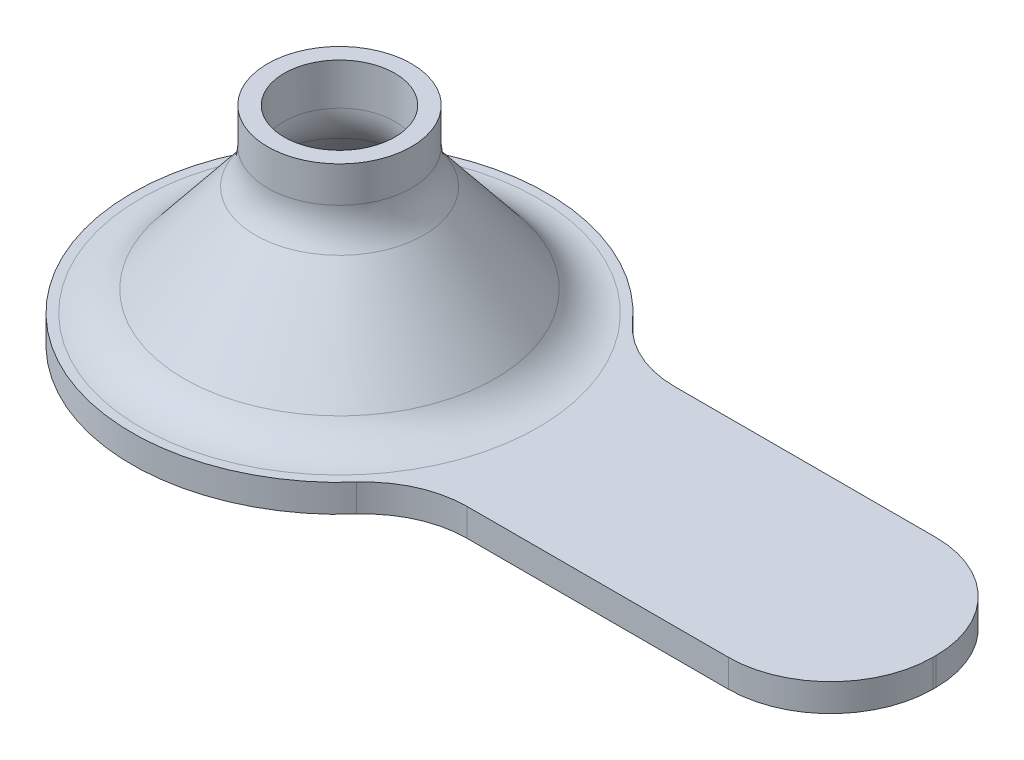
SolidWorks part; units mm, degrees
ref_plane "Front Plane" through (0, 0, 0) normal (0, 0, 1) x (1, 0, 0)
ref_plane "Top Plane" through (0, 0, 0) normal (0, 1, 0) x (1, 0, 0)
ref_plane "Right Plane" through (0, 0, 0) normal (1, 0, 0) x (0, 0, -1)
sketch "Sketch1" plane through (0, 0, 0) normal (0, 0, 1) x (1, 0, 0)
  line L0 (0, 0) -> (0, 14.1378) construction
  line L1 (8.915, 0) -> (3.302, 6.985)
  line L2 (3.302, 6.985) -> (3.302, 9.525)
  line L3 (3.302, 9.525) -> (2.54, 9.525)
  line L4 (2.54, 9.525) -> (2.54, 6.7168)
  line L5 (2.54, 6.7168) -> (7.9375, 0)
  line L6 (7.9375, 0) -> (8.915, 0)
  dimension "D1" = 6.604
  dimension "D2" = 0.762
  dimension "D3" = 0.762
  dimension "D4" = 15.875
  dimension "D5" = 9.525
  dimension "D6" = 2.54
revolve "Revolve1" add sketch "Sketch1" angle 360 about L0
fillet "Fillet1" radius 2.54 2 edges at (0, 6.7168, -2.54) (0, 6.985, -3.302)
sketch "Sketch2" plane through (0, 0, 0) normal (0, -1, 0) x (1, 0, 0)
  line L1 (8.2489, 4.7625) -> (27.2989, 4.7625)
  line L3 (8.2489, -4.7625) -> (27.2989, -4.7625)
  line L4 (27.2989, 4.7625) -> (27.2989, -4.7625)
  circle A0 centre (0, 0) radius 7.62
  arc A1 (8.2489, 4.7625) -> (8.2489, -4.7625) centre (0, 0) ccw
  point P9 (27.2989, 0)
  dimension "D1" = 19.05
  dimension "D2" = 15.24
  dimension "D3" = 9.525
  dimension "D4" = 19.05
extrude "Boss-Extrude1" add sketch "Sketch2" against normal blind 1.27
fillet "Fillet2" radius 2.54 2 edges at (0, 0, -7.62) (0, 1.27, -7.8945)
fillet "Fillet3" radius 4.699 4 edges at (27.2989, 0.635, 4.7625) (27.2989, 0.635, -4.7625) (8.2489, 0.635, -4.7625) (8.2489, 0.635, 4.7625)
